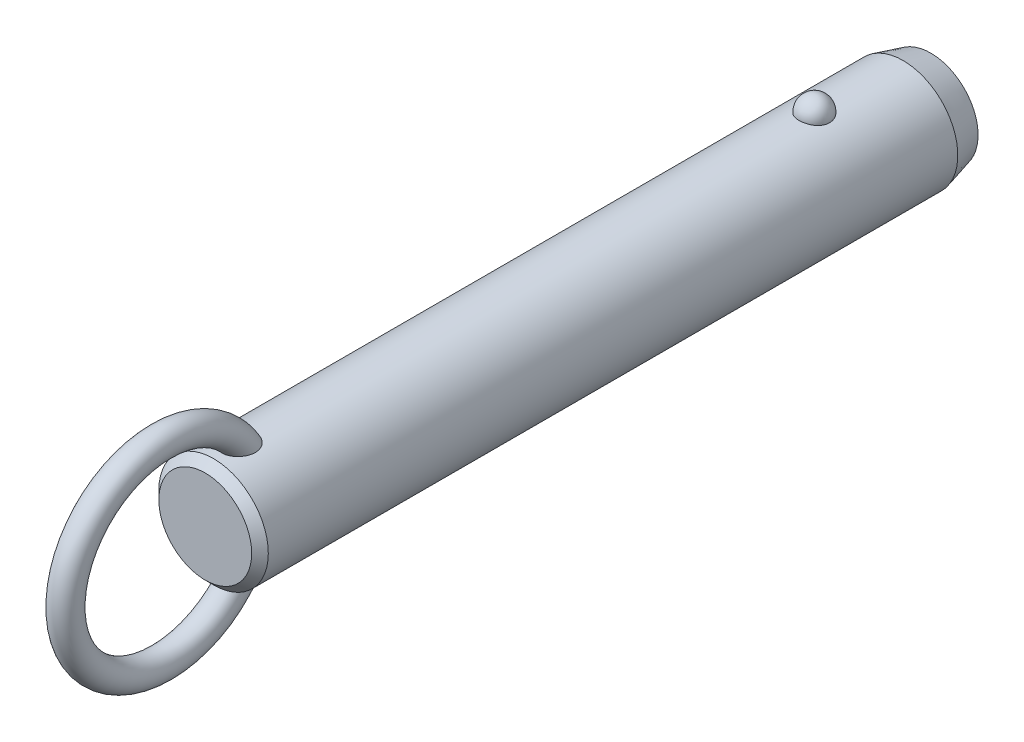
SolidWorks part; units mm, degrees
ref_plane "Front Plane" through (0, 0, 0) normal (0, 0, 1) x (1, 0, 0)
ref_plane "Top Plane" through (0, 0, 0) normal (0, 1, 0) x (1, 0, 0)
ref_plane "Right Plane" through (0, 0, 0) normal (1, 0, 0) x (0, 0, -1)
sketch "Sketch2" plane through (0, 0, 0) normal (0, 0, 1) x (1, 0, 0)
  circle A0 centre (0, 0) radius 7.9
  point P3 (0, 7.9)
  dimension "D1" = 15.8
extrude "Boss-Extrude1" add sketch "Sketch2" along normal blind 76.2
sketch "Sketch3" plane through (0, 0, 0) normal (0, 0, -1) x (-1, 0, 0)
  circle A0 centre (0, 0) radius 7.9
  dimension "D1" = 15.8
extrude "Boss-Extrude2" add sketch "Sketch3" along normal blind 19
chamfer "Chamfer1" distance 4 angle 15 1 edges at (-7.9, 0, -19)
sketch "Sketch12" plane through (0, 0, 0) normal (1, 0, 0) x (0, 0, -1)
  line L0 (-76.2, 7.9) -> (-76.2, -7.9) construction
  point P0 (-76.2, 0)
sketch "Sketch13" plane through (0, 0, 0) normal (1, 0, 0) x (0, 0, -1)
  circle A0 centre (-92.05, 0) radius 15.85
  point P2 (-76.2, 0)
  dimension "D1" = 31.7
sketch "Sketch14" plane through (0, 0, 0) normal (0, 1, 0) x (1, 0, 0)
  circle A0 centre (0, -78.2) radius 2
  point P2 (0, -76.2)
  dimension "D1" = 4
sweep "Sweep1" add profiles "Sketch14" path "Sketch13"
sketch "Sketch15" plane through (0, 0, 76.2) normal (0, 0, 1) x (1, 0, 0)
  circle A0 centre (0, 0) radius 7.9
  dimension "D1" = 15.8
extrude "Boss-Extrude3" add sketch "Sketch15" along normal blind 9.52
chamfer "Chamfer2" distance 1.2 angle 45 1 edges at (7.9, 0, 85.72)
sketch "Sketch18" plane through (0, 0, 0) normal (1, 0, 0) x (0, 0, -1)
  line L0 (15, 7.9) -> (-78.3091, 7.9) construction
  line L1 (2.2, 10.1) -> (2.2, 5.7)
  line L2 (-78.3091, -7.9) -> (15, -7.9) construction
  arc A0 (2.2, 10.1) -> (2.2, 5.7) centre (2.2, 7.9) ccw
  point P4 (0, 7.9)
  dimension "D1" = 18
revolve "Revolve1" add sketch "Sketch18" angle 360 about L1
